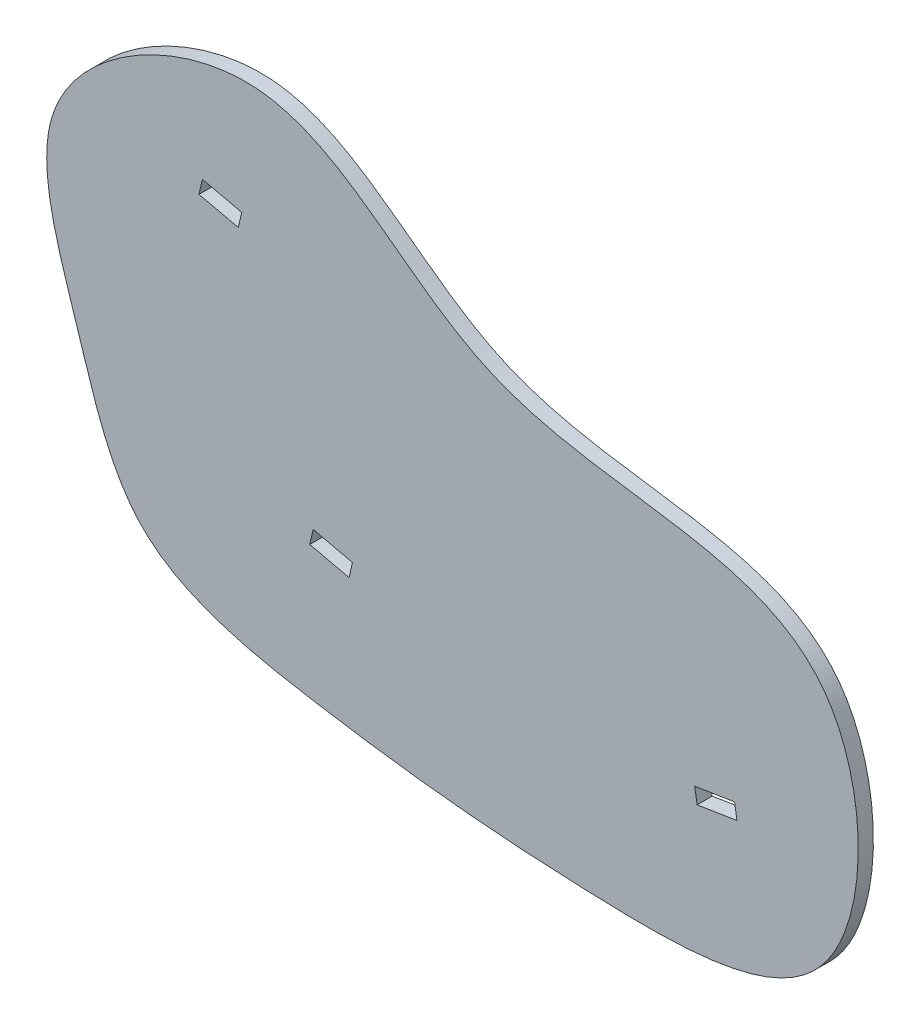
SolidWorks part; units mm, degrees
ref_plane "Plan de face" through (0, 0, 0) normal (0, 0, 1) x (1, 0, 0)
ref_plane "Plan de dessus" through (0, 0, 0) normal (0, 1, 0) x (1, 0, 0)
ref_plane "Plan de droite" through (0, 0, 0) normal (1, 0, 0) x (0, 0, -1)
sketch "Esquisse1" plane through (0, 0, 0) normal (0, 0, 1) x (1, 0, 0)
  spline S0 degree 3 poles (26.4619, 18.7347) (-12.0449, 72.537) (-68.7283, 40.4799) (-54.0533, 1.3317) (-44.6534, -33.433) (1.6581, -42.8809) (42.2973, -46.8442) (102.9684, -46.4335) (102.7409, 33.6307) (26.4619, 18.7347) (-12.0449, 72.537) (-68.7283, 40.4799) knots -0.404532 -0.29326 -0.125339 0 0.110992 0.194397 0.268192 0.351801 0.490835 0.595468 0.70674 0.874661 1 1.110992 1.194397 1.268192 only from (-18.8642, 58.9346) to (-18.8642, 58.9346)
extrude "Boss.-Extru.1" add sketch "Esquisse1" along normal blind 3
ref_plane "Plan1" through (76.0847, -16.2083, 0) normal (-0.9877, -0.1564, 0) x (0, 0, 1)
sketch "Esquisse3" plane through (0, 0, 3) normal (0, 0, 1) x (1, 0, 0)
  line L7 (68.1832, -17.4598) -> (68.6525, -20.4229) construction
  line L12 (68.1832, -17.4598) -> (68.6525, -20.4229)
  line L13 (76.0847, -16.2083) -> (76.554, -19.1714) construction
  line L16 (76.0847, -16.2083) -> (76.554, -19.1714)
  line L18 (68.6525, -20.4229) -> (76.554, -19.1714)
  line L19 (68.1832, -17.4598) -> (76.0847, -16.2083)
  line L20 (-0.3544, -15.9034) -> (0.3149, -12.979) construction
  line L21 (-8.1528, -14.1188) -> (-7.4835, -11.1944) construction
  line L35 (-0.3544, -15.9034) -> (0.3149, -12.979)
  line L36 (-8.1528, -14.1188) -> (-7.4835, -11.1944)
  line L37 (-8.1528, -14.1188) -> (-0.3544, -15.9034)
  line L38 (-7.4835, -11.1944) -> (0.3149, -12.979)
  line L39 (-30.1161, 35.0192) -> (-29.4469, 37.9436) construction
  line L40 (-22.3177, 33.2345) -> (-21.6485, 36.1589) construction
  line L41 (-22.3177, 33.2345) -> (-21.6485, 36.1589)
  line L42 (-30.1161, 35.0192) -> (-29.4469, 37.9436)
  line L43 (-30.1161, 35.0192) -> (-22.3177, 33.2345)
  line L44 (-29.4469, 37.9436) -> (-21.6485, 36.1589)
extrude "Enlèv. mat.-Extru.1" cut sketch "Esquisse3" against normal blind 10
